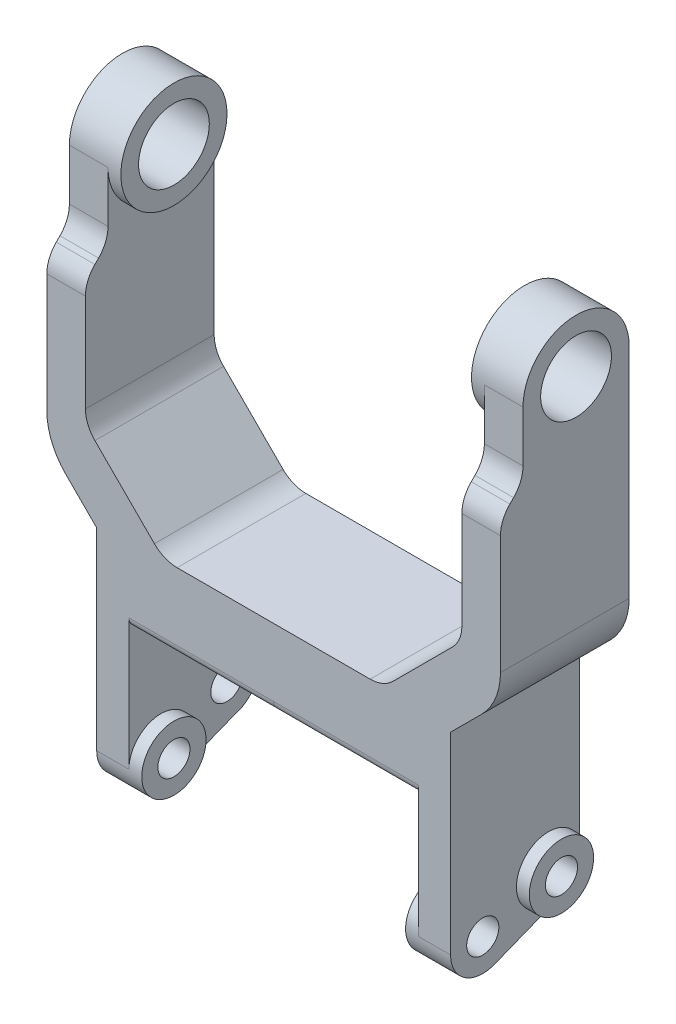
SolidWorks part; units mm, degrees
ref_plane "Face" through (0, 0, 0) normal (0, 0, 1) x (1, 0, 0)
ref_plane "Dessus" through (0, 0, 0) normal (0, 1, 0) x (1, 0, 0)
ref_plane "Droite" through (0, 0, 0) normal (1, 0, 0) x (0, 0, -1)
sketch "Esquisse1" plane through (0, 0, 0) normal (0, 0, 1) x (1, 0, 0)
  line L0 (58.5, 28.5) -> (58.5, 90)
  line L1 (58.5, 90) -> (70.5, 90)
  line L2 (70.5, 90) -> (70.5, 22.0147)
  line L3 (64.6421, 7.8726) -> (46.6274, -10.1421)
  line L4 (32.4853, -16) -> (0, -16)
  line L5 (0, -16) -> (0, 0)
  line L6 (0, 0) -> (30, 0)
  line L7 (37.0711, 2.9289) -> (55.5711, 21.4289)
  arc A0 (55.5711, 21.4289) -> (58.5, 28.5) centre (48.5, 28.5) ccw
  arc A1 (30, 0) -> (37.0711, 2.9289) centre (30, 10) ccw
  arc A2 (70.5, 22.0147) -> (64.6421, 7.8726) centre (50.5, 22.0147) cw
  arc A3 (46.6274, -10.1421) -> (32.4853, -16) centre (32.4853, 4) cw
  dimension "D4" = 10
  dimension "D5" = 20
  dimension "D1" = 12
  dimension "D2" = 16
  dimension "D3" = 16
  dimension "D6" = 58.5
  dimension "D7" = 30
  dimension "D8" = 135
  dimension "D9" = 90
extrude "Base-Extrusion" add sketch "Esquisse1" along normal mid plane 40
sketch "Esquisse2" plane through (70.5, 0, 0) normal (1, 0, 0) x (0, 0, -1)
  line L0 (-13, 90) -> (-13, 74.1421)
  line L1 (-15.9289, 67.0711) -> (-17.0711, 65.9289)
  line L2 (-20, 58.8579) -> (-20, 16.5)
  line L3 (-20, 22.0147) -> (-20, 90) construction
  line L4 (-20, 16.5) -> (-30, 16.5)
  line L5 (-30, 16.5) -> (-30, 90)
  line L6 (-30, 90) -> (-13, 90)
  line L7 (20, 22.0147) -> (20, 90) construction
  line L8 (-20, 90) -> (20, 90) construction
  arc A0 (-13, 74.1421) -> (-15.9289, 67.0711) centre (-23, 74.1421) cw
  arc A1 (-17.0711, 65.9289) -> (-20, 58.8579) centre (-10, 58.8579) ccw
  point P14 (-13, 70)
  point P17 (-20, 63)
  dimension "D4" = 10
  dimension "D1" = 33
  dimension "D2" = 20
  dimension "D3" = 135
extrude "Enlèv. mat.-Extru.1" cut sketch "Esquisse2" against normal through all
sketch "Esquisse4" plane through (70.5, 0, 0) normal (1, 0, 0) x (0, 0, -1)
  line L1 (-13, 90) -> (20, 90) construction
  circle A0 centre (3.5, 90) radius 16.5
  dimension "D1" = 33
extrude "Boss.-Extru.1" add sketch "Esquisse4" against normal blind 16
sketch "Esquisse6" plane through (0, 0, 20) normal (0, 0, 1) x (1, 0, 0)
  line L0 (0, -16) -> (32.4853, -16)
  line L1 (46.6274, -10.1421) -> (64.6421, 7.8726) construction
  line L2 (55, -1.7696) -> (51.6824, -1.6099)
  line L3 (55, -1.7696) -> (55, -24)
  line L4 (0, -16) -> (0, -24)
  line L5 (0, -24) -> (55, -24)
  line L6 (0, -16) -> (32.4853, -16) construction
  arc A0 (32.4853, -16) -> (46.6274, -10.1421) centre (32.4853, 4) ccw construction
  arc A1 (51.6824, -1.6099) -> (32.4853, -16) centre (32.4853, 4) cw
  dimension "D1" = 55
  dimension "D2" = 8
extrude "Boss.-Extru.4" add sketch "Esquisse6" against normal blind 10
fillet "Congé1" radius 3
sketch "Esquisse15" plane through (55, 0, 0) normal (1, 0, 0) x (0, 0, -1)
  line L0 (-20, -1.7696) -> (20, -1.7696)
  line L1 (20, -1.7696) -> (20, -56.7696)
  line L2 (-20, -1.7696) -> (-20, -61.7696)
  line L3 (-6.3248, -71.0697) -> (15.277, -62.5333)
  line L4 (-10, -16) -> (20, -16) construction
  line L5 (-20, 22.0147) -> (-20, 7.8726) construction
  line L6 (20, 7.8726) -> (20, 22.0147) construction
  arc A0 (-6.3248, -71.0697) -> (-20, -61.7696) centre (-10, -61.7696) cw
  arc A1 (20, -56.7696) -> (15.277, -62.5333) centre (10.4606, -53.7696) cw
  dimension "D1" = 60
  dimension "D3" = 10
  dimension "D4" = 10
  dimension "D2" = 55
  dimension "D5" = 14.2304
  dimension "D7" = 52
extrude "Boss.-Extru.5" add sketch "Esquisse15" against normal blind 10
sketch "Esquisse17" plane through (45, 0, 0) normal (-1, 0, 0) x (0, 0, 1)
  circle A0 centre (10, -61.7696) radius 10
extrude "Boss.-Extru.6" add sketch "Esquisse17" along normal blind 4
sketch "Esquisse18" plane through (55, 0, 0) normal (1, 0, 0) x (0, 0, -1)
  circle A0 centre (10.4606, -53.7696) radius 10
extrude "Boss.-Extru.7" add sketch "Esquisse18" along normal blind 4
mirror "Symétrie1"
sketch "Esquisse16" plane through (55, 0, 0) normal (1, 0, 0) x (0, 0, -1)
  circle A0 centre (10.4606, -53.7696) radius 5
  circle A1 centre (-10, -61.7696) radius 5
  dimension "D1" = 10
  dimension "D2" = 10
extrude "Enlèv. mat.-Extru.5" cut sketch "Esquisse16" against normal mid plane 400
sketch "Esquisse19" plane through (70.5, 0, 0) normal (1, 0, 0) x (0, 0, -1)
  circle A0 centre (3.5, 90) radius 11
  dimension "D1" = 22
extrude "Enlèv. mat.-Extru.6" cut sketch "Esquisse19" against normal through all
